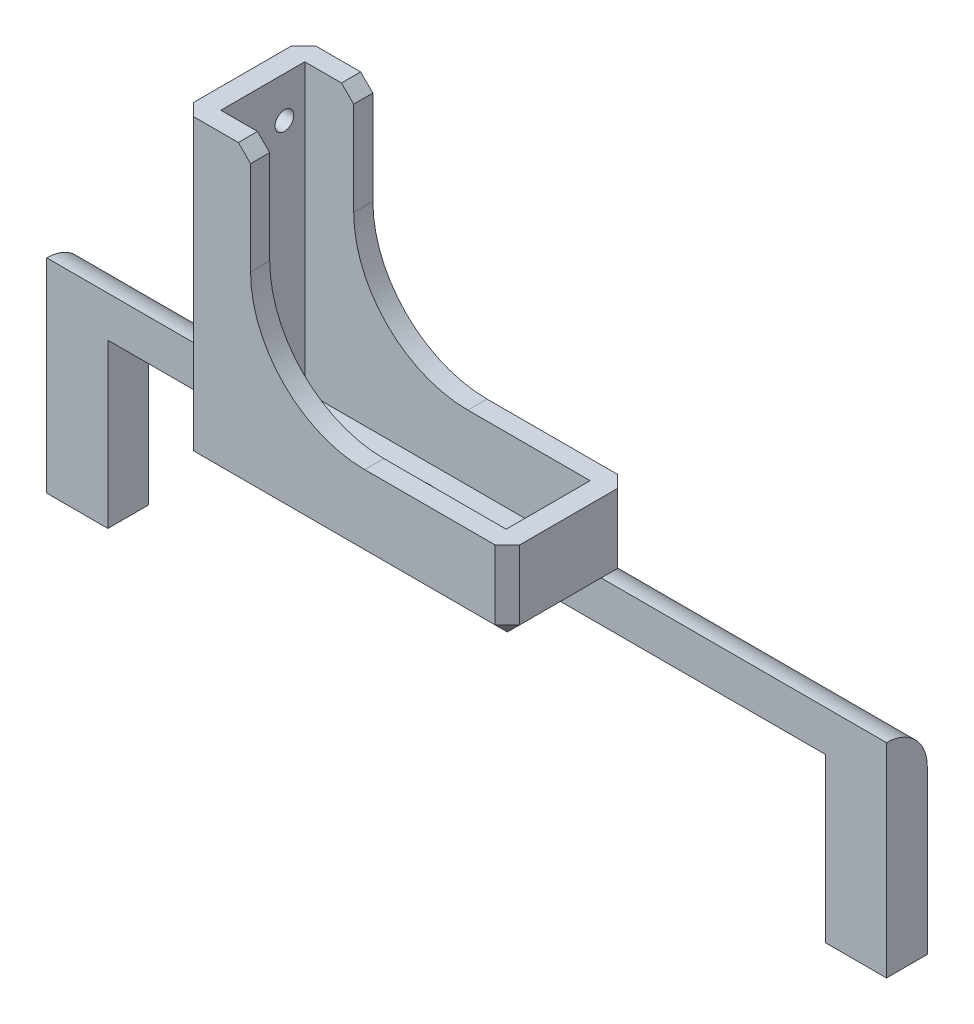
SolidWorks part; units mm, degrees
ref_plane "前视基准面" through (0, 0, 0) normal (0, 0, 1) x (1, 0, 0)
ref_plane "上视基准面" through (0, 0, 0) normal (0, 1, 0) x (1, 0, 0)
ref_plane "右视基准面" through (0, 0, 0) normal (1, 0, 0) x (0, 0, -1)
other "Configuration Table"
sketch "草图1" plane through (0, 0, 0) normal (0, 1, 0) x (1, 0, 0)
  line L5 (-7.5, 4) -> (7.5, 4)
  line L6 (-7.5, 4) -> (-7.5, -4)
  line L7 (-7.5, -4) -> (7.5, -4)
  line L8 (7.5, 4) -> (7.5, -4)
  line L9 (-7.5, 4) -> (7.5, -4) construction
  line L10 (-7.5, -4) -> (7.5, 4) construction
  point P0 (0, 0)
  dimension "D1" = 8
  dimension "D2" = 15
extrude "凸台-拉伸1" add sketch "草图1" along normal blind 7
sketch "草图4" plane through (0, 7, 0) normal (0, 1, 0) x (1, 0, 0)
  line L1 (-20, 4) -> (20, 4)
  line L2 (-20, 4) -> (-20, -11)
  line L3 (-20, -11) -> (20, -11)
  line L4 (20, 4) -> (20, -11)
  line L5 (-20, 4) -> (20, -11) construction
  line L6 (-20, -11) -> (20, 4) construction
  line L7 (7.5, 4) -> (-7.5, 4) construction
  point P0 (0, -3.5)
  dimension "D1" = 40
  dimension "D2" = 15
extrude "凸台-拉伸3" add sketch "草图4" against normal blind 2
sketch "草图5" plane through (0, 7, 0) normal (0, 1, 0) x (1, 0, 0)
  line L1 (-20, 4) -> (20, 4)
  line L2 (-20, 4) -> (-20, -11)
  line L3 (-20, -11) -> (20, -11)
  line L4 (20, 4) -> (20, -11)
  line L5 (-20, 4) -> (20, -11) construction
  line L6 (-20, -11) -> (20, 4) construction
  line L7 (-17.5, 1.65) -> (17.5, 1.65)
  line L8 (-17.5, 1.65) -> (-17.5, -8.65)
  line L9 (-17.5, -8.65) -> (17.5, -8.65)
  line L10 (17.5, 1.65) -> (17.5, -8.65)
  line L11 (-17.5, 1.65) -> (17.5, -8.65) construction
  line L12 (-17.5, -8.65) -> (17.5, 1.65) construction
  point P0 (0, -3.5)
  point P7 (0, -3.5)
  dimension "D1" = 35
  dimension "D2" = 10.3
extrude "凸台-拉伸4" add sketch "草图5" along normal blind 35
sketch "草图6" plane through (0, 0, -4) normal (0, 0, -1) x (-1, 0, 0)
  line L0 (-20, 42) -> (20, 42) construction
  line L1 (-11.5, 42) -> (11.5, 42)
  line L2 (-11.5, 42) -> (-11.5, 15)
  line L3 (-11.5, 15) -> (11.5, 15)
  line L4 (11.5, 42) -> (11.5, 15)
  line L5 (-17.5, 42) -> (-17.5, 7) construction
  line L7 (17.5, 42) -> (17.5, 7) construction
  line L8 (17.5, 7) -> (-17.5, 7) construction
  dimension "D1" = 6
  dimension "D2" = 6
  dimension "D3" = 8
extrude "切除-拉伸1" cut sketch "草图6" against normal through all
sketch "草图8" plane through (-20, 0, 0) normal (-1, 0, 0) x (0, 0, 1)
  line L0 (8.65, 7) -> (-1.65, 7) construction
  line L5 (-1.65, 37.9869) -> (-1.65, 16.6611) construction
  line L6 (-1.65, 42) -> (-1.65, 7) construction
  circle A0 centre (0.85, 37) radius 1.15
  dimension "D1" = 2.3
  dimension "D2" = 30
  dimension "D3" = 2.5
extrude "切除-拉伸3" cut sketch "草图8" against normal up to next
sketch "草图9" plane through (-20, 0, 0) normal (-1, 0, 0) x (0, 0, 1)
  circle A0 centre (0.85, 37) radius 2.5
extrude "切除-拉伸4" cut sketch "草图9" against normal blind 0.1
mirror "镜向2" about plane through (0, 0, 0) normal (1, 0, 0) of "切除-拉伸4", "切除-拉伸3"
sketch "草图11" plane through (-7.5, 0, 0) normal (-1, 0, 0) x (0, 0, 1)
  line L0 (4, 0) -> (-4, 0)
  line L2 (-4, 0) -> (-4, -20)
  line L3 (-4, -20) -> (4, -20)
  line L4 (4, -20) -> (4, 0)
  dimension "D2" = 20
extrude "凸台-拉伸6" add sketch "草图11" against normal up to surface (15 mm away)
sketch "草图12" plane through (0, 0, -4) normal (0, 0, -1) x (-1, 0, 0)
  line L1 (-4.5, -19.5) -> (4.5, -19.5)
  line L2 (-4.5, -19.5) -> (-4.5, 5)
  line L3 (-4.5, 5) -> (4.5, 5)
  line L4 (4.5, -19.5) -> (4.5, 5)
  line L6 (7.5, 5) -> (20, 5) construction
  line L7 (-7.5, -20) -> (-7.5, 5) construction
  line L8 (7.5, 5) -> (7.5, -20) construction
  line L9 (-7.5, -20) -> (7.5, -20) construction
  dimension "D1" = 3
  dimension "D2" = 3
  dimension "D3" = 0.5
extrude "切除-拉伸5" cut sketch "草图12" against normal through all and the other way through all
sketch "草图13" plane through (0, -20, 0) normal (0, -1, 0) x (-1, 0, 0)
  line L0 (-7.5, 4) -> (7.5, 4) construction
  circle A0 centre (0, 4) radius 3
extrude "切除-拉伸6" cut sketch "草图13" against normal up to next
sketch "草图14" plane through (0, 42, 0) normal (0, 1, 0) x (1, 0, 0)
  line L1 (5.288, 11.6653) -> (30.4242, 11.6653)
  line L2 (5.288, 11.6653) -> (5.288, -17.3547)
  line L3 (5.288, -17.3547) -> (30.4242, -17.3547)
  line L4 (30.4242, 11.6653) -> (30.4242, -17.3547)
extrude "切除-拉伸7" cut sketch "草图14" against normal up to surface (27 mm away)
fillet "圆角1" radius 14 2 edges at (-11.5, 15, 9.825) (-11.5, 15, -2.825)
chamfer "倒角1" distance 1.5 angle 45 15 edges at (-7.5, 5, 0) (-4.5, 5, 0) (4.5, 5, 0) (7.5, 5, 0) (-20, 5, 3.5) (20, 5, 3.5) (-11.5, 42, 9.825) (-11.5, 42, -2.825) (-20, 23.5, 11) (-20, 23.5, -4) (20, 10, 11) (20, 10, -4) (0, 5, 11) (6, 5, 4) (-6, 5, 4)
sketch "草图17" plane through (7.5, 0, 0) normal (1, 0, 0) x (0, 0, -1)
  line L1 (4, -20) -> (-4, -20)
  line L2 (4, -20) -> (4, 3)
  line L3 (4, 3) -> (-4, 3)
  line L4 (-4, -20) -> (-4, 3)
  line L5 (4, 3.5) -> (-4, 3.5) construction
  line L7 (-4, -20) -> (4, -20) construction
  line L8 (4, 3.5) -> (4, -20) construction
  dimension "D1" = 0
  dimension "D2" = 0.5
extrude "切除-拉伸8" cut sketch "草图17" against normal blind 20
sketch "草图18" plane through (7.5, 0, 0) normal (1, 0, 0) x (0, 0, -1)
  line L2 (4, -22) -> (9, -22)
  line L3 (-4, 3) -> (4, 3)
  line L4 (9, -2) -> (9, -22)
  line L8 (4, -22) -> (4, 0)
  arc A1 (4, 3) -> (9, -2) centre (4, -2) cw
  arc A3 (-4, 3) -> (4, 0) centre (3.4289, 10.6437) ccw
  dimension "D1" = 5
  dimension "D2" = 8
extrude "凸台-拉伸7" add sketch "草图18" against normal up to surface (15 mm away)
sketch "草图19" plane through (0, 7, 0) normal (0, 1, 0) x (1, 0, 0)
  circle A0 centre (0, -3.5977) radius 3
extrude "切除-拉伸9" cut sketch "草图19" against normal blind 10
sketch "草图20" plane through (0, -22, 0) normal (0, -1, 0) x (1, 0, 0)
  line L1 (-7.5, -9) -> (7.5, -9)
  line L2 (-7.5, -9) -> (-7.5, -4)
  line L4 (7.5, -9) -> (7.5, -4)
  line L6 (-7.5, -4) -> (7.5, -4)
extrude "切除-拉伸10" cut sketch "草图20" against normal blind 20
sketch "草图21" plane through (-7.5, 0, 0) normal (-1, 0, 0) x (0, 0, 1)
  line L2 (-4, 3) -> (-4, -2)
  line L3 (-4, -2) -> (-9, -2)
  arc A1 (-4, 3) -> (-9, -2) centre (-4, -2) ccw
  arc A2 (-4, 3) -> (-9, -2) centre (-4, -2) ccw construction
extrude "凸台-拉伸8" add sketch "草图21" along normal blind 44
sketch "草图22" plane through (7.5, 0, 0) normal (1, 0, 0) x (0, 0, -1)
  line L1 (4, -2) -> (9, -2)
  line L2 (4, -2) -> (4, 3)
  arc A2 (9, -2) -> (4, 3) centre (4, -2) ccw
extrude "凸台-拉伸9" add sketch "草图22" along normal blind 44
sketch "草图23" plane through (0, -2, 0) normal (0, -1, 0) x (1, 0, 0)
  line L1 (-51.5, -9) -> (-44, -9)
  line L2 (-51.5, -9) -> (-51.5, -4)
  line L3 (-51.5, -4) -> (-44, -4)
  line L4 (-44, -9) -> (-44, -4)
  line L5 (51.5, -4) -> (-51.5, -4) construction
  line L6 (51.5, -9) -> (44, -9)
  line L7 (51.5, -9) -> (51.5, -4)
  line L8 (51.5, -4) -> (44, -4)
  line L9 (44, -9) -> (44, -4)
  dimension "D1" = 7.5
  dimension "D2" = 7.5
  dimension "D3" = 0
  dimension "D4" = 0
extrude "凸台-拉伸10" add sketch "草图23" along normal blind 20
